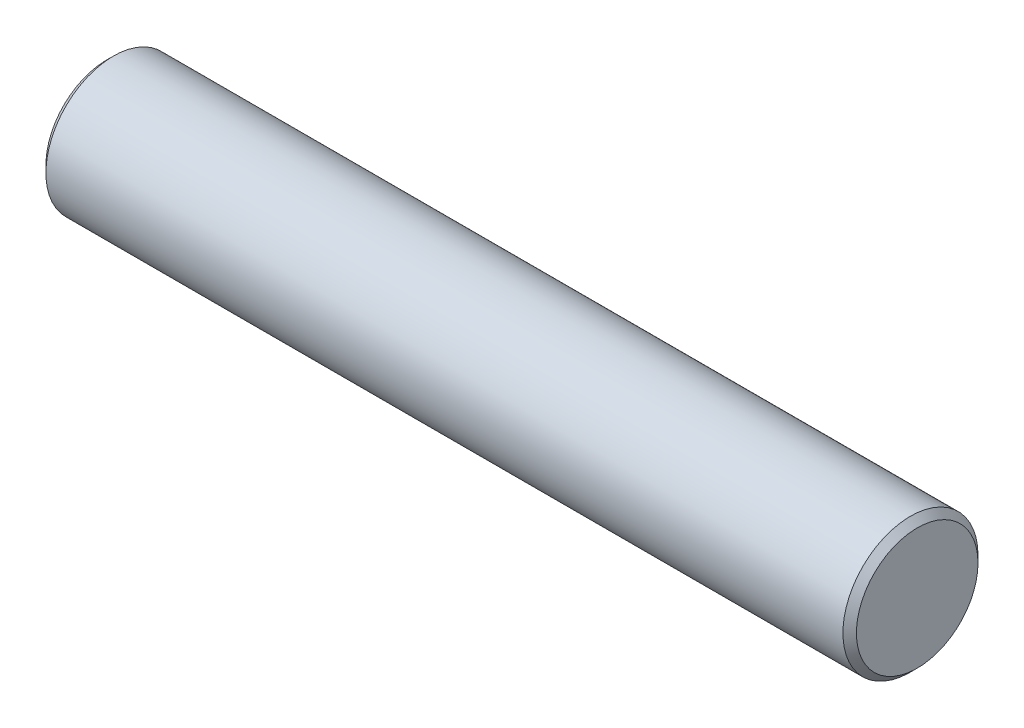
SolidWorks part; units mm, degrees
ref_plane "Front Plane" through (0, 0, 0) normal (0, 0, 1) x (1, 0, 0)
ref_plane "Top Plane" through (0, 0, 0) normal (0, 1, 0) x (1, 0, 0)
ref_plane "Right Plane" through (0, 0, 0) normal (1, 0, 0) x (0, 0, -1)
sketch "Sketch1" plane through (0, 0, 0) normal (1, 0, 0) x (0, 0, -1)
  circle A0 centre (0, 0) radius 1
  dimension "D1" = 2
extrude "Boss-Extrude1" add sketch "Sketch1" along normal blind 12
chamfer "Chamfer1" distance 0.1 angle 45 1 edges at (0, 0, -1)
chamfer "Chamfer2" distance 0.1 angle 45 1 edges at (12, 0, -1)
ref_plane "Plane1" through (6, 0, 0) normal (1, 0, 0) x (0, 0, -1)
